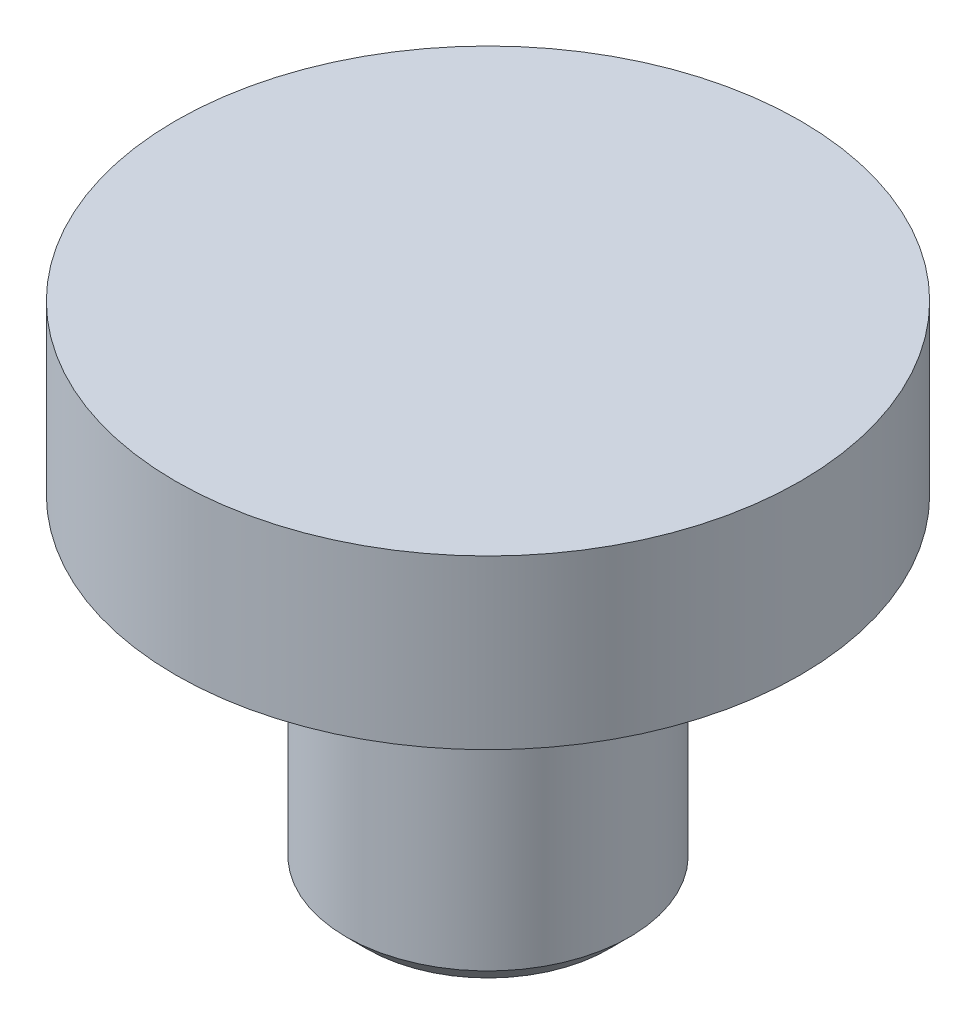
SolidWorks part; units mm, degrees
ref_plane "Plan de face" through (0, 0, 0) normal (0, 0, 1) x (1, 0, 0)
ref_plane "Plan de dessus" through (0, 0, 0) normal (0, 1, 0) x (1, 0, 0)
ref_plane "Plan de droite" through (0, 0, 0) normal (1, 0, 0) x (0, 0, -1)
sketch "Esquisse1" plane through (0, 0, 0) normal (0, 1, 0) x (1, 0, 0)
  circle A0 centre (0, 0) radius 3.4
  dimension "D1" = 6.8
extrude "Extrusion1" add sketch "Esquisse1" along normal blind 8
sketch "Esquisse2" plane through (0, 8, 0) normal (0, 1, 0) x (1, 0, 0)
  circle A0 centre (0, 0) radius 7.5
  dimension "D1" = 15
extrude "Extrusion2" add sketch "Esquisse2" along normal blind 4.0286
chamfer "Chanfrein1" distance 0.5 angle 45 1 edges at (0, 0, 3.4)
